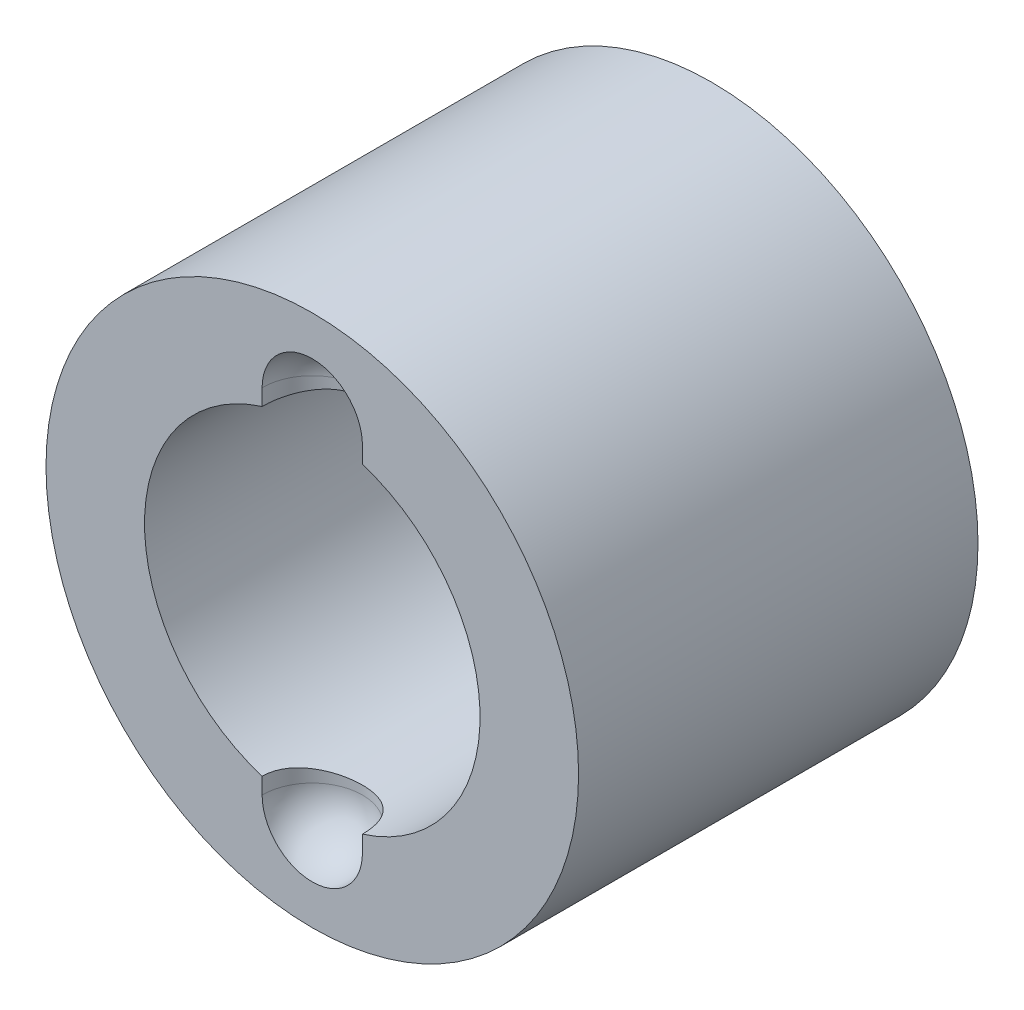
SolidWorks part; units mm, degrees
ref_plane "Plane1" through (0, 0, 0) normal (0, 0, 1) x (1, 0, 0)
ref_plane "Plane2" through (0, 0, 0) normal (0, 1, 0) x (1, 0, 0)
ref_plane "Plane3" through (0, 0, 0) normal (1, 0, 0) x (0, 0, -1)
sketch "Sketch1" plane through (0, 0, 0) normal (0, 0, 1) x (1, 0, 0)
  circle A0 centre (0, 0) radius 12.7
  circle A1 centre (0, 0) radius 8.001
  dimension "D1" = 16.002
  dimension "D2" = 25.4
extrude "Base-Extrude" add sketch "Sketch1" along normal blind 19.05
sketch "Sketch2" plane through (0, 0, 19.05) normal (0, 0, 1) x (1, 0, 0)
  line L0 (0, 0) -> (0, 14.4868) construction
  line L2 (2.3927, 8.4121) -> (2.3927, -8.4121)
  line L3 (0, 10.8054) -> (0, -10.8054)
  arc A1 (0, -10.8054) -> (2.3927, -8.4121) centre (-0.0006, -8.4121) ccw
  arc A4 (0, 10.8054) -> (2.3927, 8.4121) centre (-0.0006, 8.4121) cw
revolve "Cut-Revolve1" cut sketch "Sketch2" angle 180 about L0
